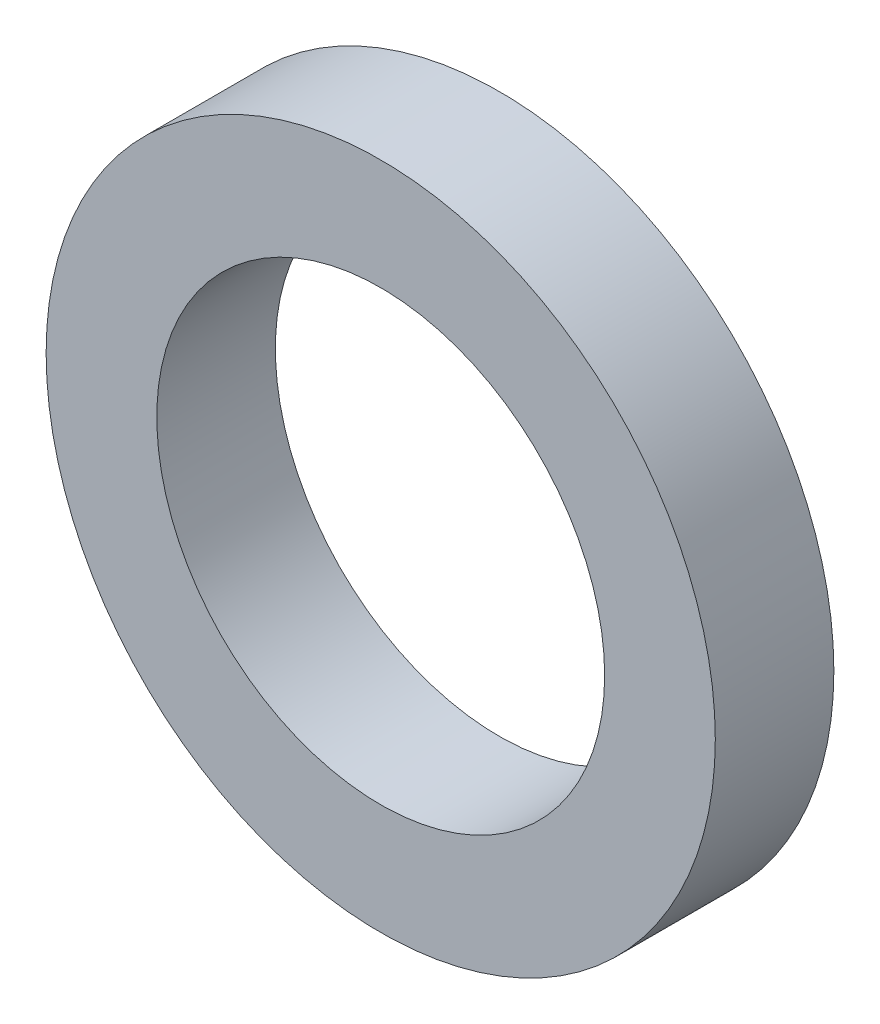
SolidWorks part; units mm, degrees
ref_plane "Front Plane" through (0, 0, 0) normal (0, 0, 1) x (1, 0, 0)
ref_plane "Top Plane" through (0, 0, 0) normal (0, 1, 0) x (1, 0, 0)
ref_plane "Right Plane" through (0, 0, 0) normal (1, 0, 0) x (0, 0, -1)
sketch "Sketch1" plane through (0, 0, 0) normal (0, 0, 1) x (1, 0, 0)
  circle A0 centre (0, 0) radius 12.7
  circle A1 centre (0, 0) radius 8.5
  dimension "D1" = 17
extrude "Boss-Extrude1" add sketch "Sketch1" along normal blind 4.5
